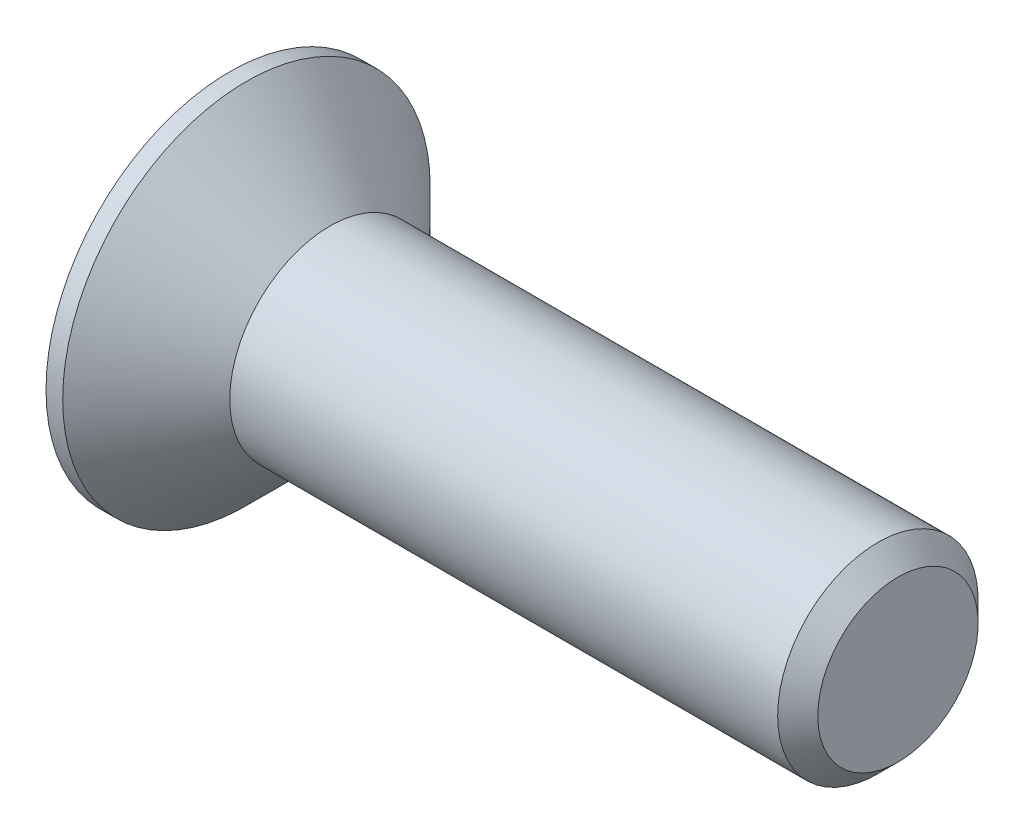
SolidWorks part; units mm, degrees
ref_plane "Front Plane" through (0, 0, 0) normal (0, 0, 1) x (1, 0, 0)
ref_plane "Top Plane" through (0, 0, 0) normal (0, 1, 0) x (1, 0, 0)
ref_plane "Right Plane" through (0, 0, 0) normal (1, 0, 0) x (0, 0, -1)
sketch "Sketch1" plane through (0, 0, 0) normal (0, 0, 1) x (1, 0, 0)
  line L1 (-3, 5.5) -> (-3, 0)
  line L2 (-3, 0) -> (17, 0)
  line L3 (17, 0) -> (17, 3)
  line L4 (17, 3) -> (0, 3)
  line L5 (-3, 5.5) -> (-2.5, 5.5)
  line L6 (-2.5, 5.5) -> (0, 3)
  dimension "D1" = 3
  dimension "D2" = 45
  dimension "D3" = 3
  dimension "D4" = 20
  dimension "D5" = 5.5
revolve "Revolve1" add sketch "Sketch1" angle 360 about L2
chamfer "Chamfer1" distance 0.6 angle 45 1 edges at (17, 0, 3)
sketch "Sketch2" plane through (-3, 0, 0) normal (-1, 0, 0) x (0, 0, 1)
  line L0 (-0.825, 3.3) -> (0.825, 3.3)
  line L1 (0.825, 3.3) -> (0.825, 0.825)
  line L2 (0.825, 0.825) -> (3.3, 0.825)
  line L3 (3.3, 0.825) -> (3.3, -0.825)
  line L4 (3.3, -0.825) -> (0.825, -0.825)
  line L5 (0.825, -0.825) -> (0.825, -3.3)
  line L6 (0.825, -3.3) -> (-0.825, -3.3)
  line L7 (-0.825, -3.3) -> (-0.825, -0.825)
  line L8 (-0.825, -0.825) -> (-3.3, -0.825)
  line L9 (-3.3, -0.825) -> (-3.3, 0.825)
  line L10 (-3.3, 0.825) -> (-0.825, 0.825)
  line L11 (-0.825, 0.825) -> (-0.825, 3.3)
  point P2 (0, 3.3)
  point P14 (0, -3.3)
  point P15 (3.3, 0)
  point P16 (-3.3, 0)
  dimension "D1" = 6.6
  dimension "D2" = 1.65
extrude "Cut-Extrude1" cut sketch "Sketch2" against normal blind 2.5
